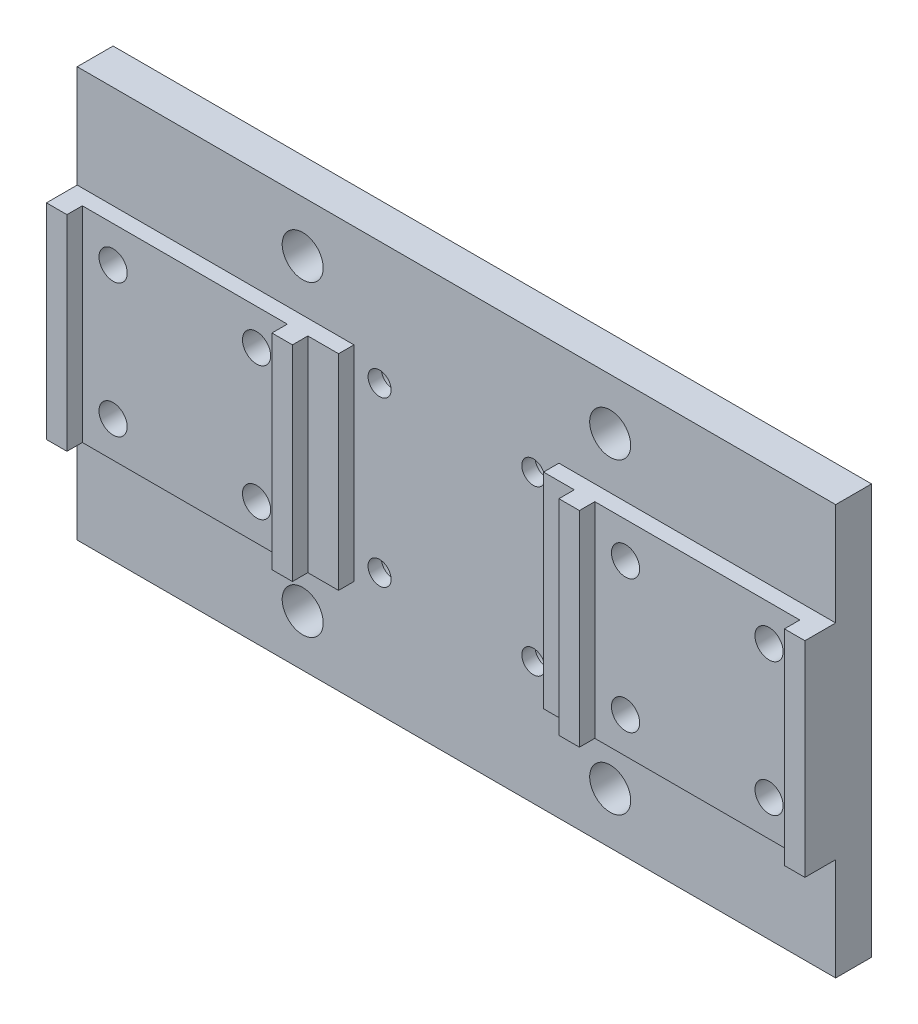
SolidWorks part; units mm, degrees
ref_plane "Plan de face" through (0, 0, 0) normal (0, 0, 1) x (1, 0, 0)
ref_plane "Plan de dessus" through (0, 0, 0) normal (0, 1, 0) x (1, 0, 0)
ref_plane "Plan de droite" through (0, 0, 0) normal (1, 0, 0) x (0, 0, -1)
sketch "Esquisse1" plane through (0, 0, 0) normal (0, 0, 1) x (1, 0, 0)
  line L0 (0, 80.3793) -> (0, -91.4076) construction
  line L1 (-74, 26.3924) -> (74, 26.3924)
  line L2 (-74, 26.3924) -> (-74, -53.6076)
  line L3 (-74, -53.6076) -> (74, -53.6076)
  line L4 (74, 26.3924) -> (74, -53.6076)
  line L5 (74, -0.6076) -> (-74, -0.6076) construction
  line L6 (74, -26.6076) -> (-74, -26.6076) construction
  line L7 (20, 26.3924) -> (20, -53.6076) construction
  line L8 (-20, 26.3924) -> (-20, -53.6076) construction
  line L9 (30, 26.3924) -> (30, -53.6076) construction
  line L10 (-30, 26.3924) -> (-30, -53.6076) construction
  line L11 (-64, -0.6076) -> (-64, -26.6076) construction
  line L12 (-36, -0.6076) -> (-36, -26.6076) construction
  line L13 (36, -0.6076) -> (36, -26.6076) construction
  line L14 (64, -0.6076) -> (64, -26.6076) construction
  line L15 (-50, 26.3924) -> (-50, -53.6076) construction
  line L16 (50, 26.3924) -> (50, -53.6076) construction
  line L21 (15, -53.6076) -> (15, 26.3924) construction
  line L22 (-15, -53.6076) -> (-15, 26.3924) construction
  circle A0 centre (-64, -0.6076) radius 2.5
  circle A1 centre (-36, -0.6076) radius 2.5
  circle A2 centre (-64, -26.6076) radius 2.5
  circle A3 centre (-36, -26.6076) radius 2.5
  circle A4 centre (36, -0.6076) radius 2.5
  circle A5 centre (64, -0.6076) radius 2.5
  circle A6 centre (36, -26.6076) radius 2.5
  circle A7 centre (64, -26.6076) radius 2.5
  circle A10 centre (15, 2.3924) radius 2
  circle A11 centre (15, -29.6076) radius 2
  circle A12 centre (-15, 2.3924) radius 2
  circle A13 centre (-15, -29.6076) radius 2
  dimension "D9" = 5
  dimension "D10" = 5
  dimension "D11" = 5
  dimension "D12" = 5
  dimension "D13" = 5
  dimension "D14" = 5
  dimension "D15" = 5
  dimension "D16" = 5
  dimension "D26" = 20
  dimension "D27" = 20
  dimension "D33" = 4
  dimension "D34" = 4
  dimension "D41" = 4
  dimension "D42" = 4
  dimension "D44" = 24
  dimension "D46" = 24
  dimension "D1" = 148
  dimension "D2" = 80
  dimension "D5" = 30
  dimension "D6" = 15
  dimension "D7" = 40
  dimension "D8" = 20
  dimension "D17" = 26
  dimension "D18" = 28
  dimension "D19" = 10
  dimension "D20" = 27
  dimension "D21" = 28
  dimension "D22" = 26
  dimension "D23" = 10
  dimension "D24" = 14
  dimension "D25" = 14
  dimension "D35" = 27
  dimension "D40" = 74
  dimension "D43" = 24
  dimension "D45" = 24
extrude "Extrusion1" add sketch "Esquisse1" along normal blind 4
sketch "Esquisse4" plane through (0, 0, 4) normal (0, 0, 1) x (1, 0, 0)
  line L0 (-74, 26.3924) -> (-74, -53.6076) construction
  line L1 (-74, 6.3924) -> (-20, 6.3924)
  line L2 (-74, 6.3924) -> (-74, -33.6076)
  line L3 (-74, -33.6076) -> (-20, -33.6076)
  line L4 (-20, 6.3924) -> (-20, -33.6076)
  line L5 (74, -53.6076) -> (74, 26.3924) construction
  line L6 (74, 6.3924) -> (20, 6.3924)
  line L7 (74, 6.3924) -> (74, -33.6076)
  line L8 (74, -33.6076) -> (20, -33.6076)
  line L9 (20, 6.3924) -> (20, -33.6076)
  line L10 (0, 26.3924) -> (0, -53.6076) construction
  line L11 (74, 26.3924) -> (-74, 26.3924) construction
  line L12 (-74, -53.6076) -> (74, -53.6076) construction
  line L13 (-74, -13.6076) -> (74, -13.6076) construction
  dimension "D1" = 40
  dimension "D2" = 20
  dimension "D3" = 40
  dimension "D4" = 40
  dimension "D5" = 20
  dimension "D6" = 20
extrude "Boss.-Extru.1" add sketch "Esquisse4" along normal blind 3
sketch "Esquisse5" plane through (0, 0, 4) normal (0, 0, -1) x (-1, 0, 0)
  circle A0 centre (-64, -0.6076) radius 2.5
  circle A1 centre (-36, -0.6076) radius 2.5
  circle A2 centre (-36, -26.6076) radius 2.5
  circle A3 centre (-64, -26.6076) radius 2.5
  circle A4 centre (36, -0.6076) radius 2.5
  circle A5 centre (64, -0.6076) radius 2.5
  circle A6 centre (64, -26.6076) radius 2.5
  circle A7 centre (36, -26.6076) radius 2.5
extrude "Enlèv. mat.-Extru.3" cut sketch "Esquisse5" against normal through all
sketch "Esquisse6" plane through (0, 0, 0) normal (0, 0, -1) x (-1, 0, 0)
  line L1 (-74, 26.3924) -> (74, 26.3924)
  line L2 (-74, 26.3924) -> (-74, -53.6076)
  line L3 (-74, -53.6076) -> (74, -53.6076)
  line L4 (74, 26.3924) -> (74, -53.6076)
extrude "Boss.-Extru.2" add sketch "Esquisse6" along normal blind 3
hole_wizard "Chambrage pour vis à tête hexagonale M41" positions "Esquisse8" profile "Esquisse7" counterbore size "M4" standard "ISO"
sketch "Esquisse8" plane through (0, 0, -3) normal (0, 0, -1) x (-1, 0, 0)
  line L0 (-74, -53.6076) -> (74, -53.6076) construction
  line L1 (74, 26.3924) -> (-74, 26.3924) construction
  line L2 (0, 26.3924) -> (0, -53.6076) construction
  point P0 (-15, 2.3924)
  point P2 (15, 2.3924)
  point P4 (15, -29.6076)
  point P6 (-15, -29.6076)
  dimension "D1" = 24
  dimension "D2" = 24
  dimension "D3" = 24
  dimension "D4" = 24
  dimension "D5" = 15
  dimension "D6" = 15
  dimension "D7" = 15
  dimension "D8" = 15
sketch "Esquisse7" plane through (15, 2.3924, -3) normal (1, 0, 0) x (0, 1, 0)
  line L0 (0, 0) -> (0, 10)
  line L1 (0, 10) -> (2.25, 10)
  line L3 (2.25, 10) -> (2.25, 4.4)
  line L4 (2.25, 4.4) -> (4, 4.4)
  line L5 (4, 4.4) -> (4, 0)
  line L7 (4, 0) -> (0, 0)
  line L11 (0, -6.35) -> (0, 107.95) construction
  dimension "Diamètre du perçage jusqu'au prochain" = 4.5
  dimension "Profondeur du perçage jusqu'au prochain" = 10
  dimension "Diamètre du chambrage" = 8
  dimension "Profondeur du chambrage" = 4.4
hole_wizard "Chambrage pour vis à tête hexagonale M51" positions "Esquisse10" profile "Esquisse9" counterbore size "M5" standard "ISO"
sketch "Esquisse10" plane through (0, 0, -3) normal (0, 0, -1) x (-1, 0, 0)
  line L0 (-30, 26.3924) -> (-30, -53.6076) construction
  line L1 (74, 26.3924) -> (-74, 26.3924) construction
  line L2 (-74, -53.6076) -> (74, -53.6076) construction
  line L5 (30, 26.3924) -> (30, -53.6076) construction
  line L8 (0, 26.3924) -> (0, -53.6076) construction
  line L11 (-74, -13.6076) -> (74, -13.6076) construction
  line L12 (-74, 26.3924) -> (-74, -53.6076) construction
  line L13 (74, -53.6076) -> (74, 26.3924) construction
  point P0 (-64, -0.6076)
  point P2 (-36, -0.6076)
  point P4 (-36, -26.6076)
  point P6 (-64, -26.6076)
  point P8 (36, -0.6076)
  point P10 (64, -0.6076)
  point P12 (64, -26.6076)
  point P14 (36, -26.6076)
  dimension "D1" = 28
  dimension "D2" = 28
  dimension "D3" = 28
  dimension "D4" = 28
  dimension "D5" = 26
  dimension "D6" = 26
  dimension "D7" = 26
  dimension "D8" = 26
  dimension "D9" = 30
  dimension "D10" = 30
  dimension "D11" = 6
  dimension "D12" = 6
  dimension "D13" = 6
  dimension "D14" = 6
  dimension "D15" = 13
  dimension "D16" = 13
  dimension "D17" = 13
  dimension "D18" = 13
sketch "Esquisse9" plane through (64, -0.6076, -3) normal (1, 0, 0) x (0, 1, 0)
  line L0 (0, 0) -> (0, 10)
  line L1 (0, 10) -> (2.75, 10)
  line L3 (2.75, 10) -> (2.75, 5.4)
  line L4 (2.75, 5.4) -> (5, 5.4)
  line L5 (5, 5.4) -> (5, 0)
  line L7 (5, 0) -> (0, 0)
  line L11 (0, -6.35) -> (0, 107.95) construction
  dimension "Diamètre du perçage jusqu'au prochain" = 5.5
  dimension "Profondeur du perçage jusqu'au prochain" = 10
  dimension "Diamètre du chambrage" = 10
  dimension "Profondeur du chambrage" = 5.4
sketch "Esquisse11" plane through (0, 0, 7) normal (0, 0, 1) x (1, 0, 0)
  line L0 (-20, 6.3924) -> (-74, 6.3924) construction
  line L3 (-30, 6.3924) -> (-26, 6.3924)
  line L5 (-30, 6.3924) -> (-30, -33.6076)
  line L6 (-20, 6.3924) -> (-74, 6.3924) construction
  line L7 (-30, -33.6076) -> (-26, -33.6076)
  line L8 (74, 6.3924) -> (20, 6.3924) construction
  line L9 (26, 6.3924) -> (30, 6.3924)
  line L10 (26, 6.3924) -> (26, -33.6076)
  line L11 (26, -33.6076) -> (30, -33.6076)
  line L12 (30, 6.3924) -> (30, -33.6076)
  line L13 (20, -33.6076) -> (74, -33.6076) construction
  line L14 (-74, 26.3924) -> (74, 26.3924) construction
  line L15 (-70, 6.3924) -> (-74, 6.3924)
  line L16 (-70, 6.3924) -> (-70, -33.6076)
  line L17 (-70, -33.6076) -> (-74, -33.6076)
  line L18 (-74, 6.3924) -> (-74, -33.6076)
  line L19 (70, 6.3924) -> (74, 6.3924)
  line L20 (70, 6.3924) -> (70, -33.6076)
  line L21 (70, -33.6076) -> (74, -33.6076)
  line L22 (74, 6.3924) -> (74, -33.6076)
  line L23 (74, 26.3924) -> (-74, 26.3924) construction
  line L24 (-26, 6.3924) -> (-26, -33.6076)
  line L25 (-74, -33.6076) -> (-20, -33.6076) construction
  point P9 (0, 26.3924)
  point P34 (0, 26.3924)
  dimension "D1" = 4
  dimension "D2" = 4
  dimension "D3" = 4
  dimension "D4" = 4
  dimension "D5" = 30
  dimension "D6" = 30
extrude "Boss.-Extru.3" add sketch "Esquisse11" along normal blind 3
sketch "Esquisse3" plane through (0, 0, 4) normal (0, 0, 1) x (1, 0, 0)
  line L0 (74, 26.3924) -> (-74, 26.3924) construction
  line L1 (-74, -53.6076) -> (74, -53.6076) construction
  line L2 (-40, 26.3924) -> (-40, -53.6076) construction
  line L3 (40, 26.3924) -> (40, -53.6076) construction
  circle A0 centre (-30, 16.3924) radius 4
  circle A1 centre (30, 16.3924) radius 4
  circle A2 centre (-30, -43.6076) radius 4
  circle A3 centre (30, -43.6076) radius 4
  point P16 (0, 26.3924)
  dimension "D4" = 10
  dimension "D9" = 10
  dimension "D10" = 10
  dimension "D11" = 8
  dimension "D12" = 8
  dimension "D13" = 8
  dimension "D14" = 8
  dimension "D1" = 10
  dimension "D2" = 10
  dimension "D3" = 10
  dimension "D5" = 80
  dimension "D6" = 40
  dimension "D7" = 10
  dimension "D8" = 10
extrude "Enlèv. mat.-Extru.2" cut sketch "Esquisse3" against normal through all
